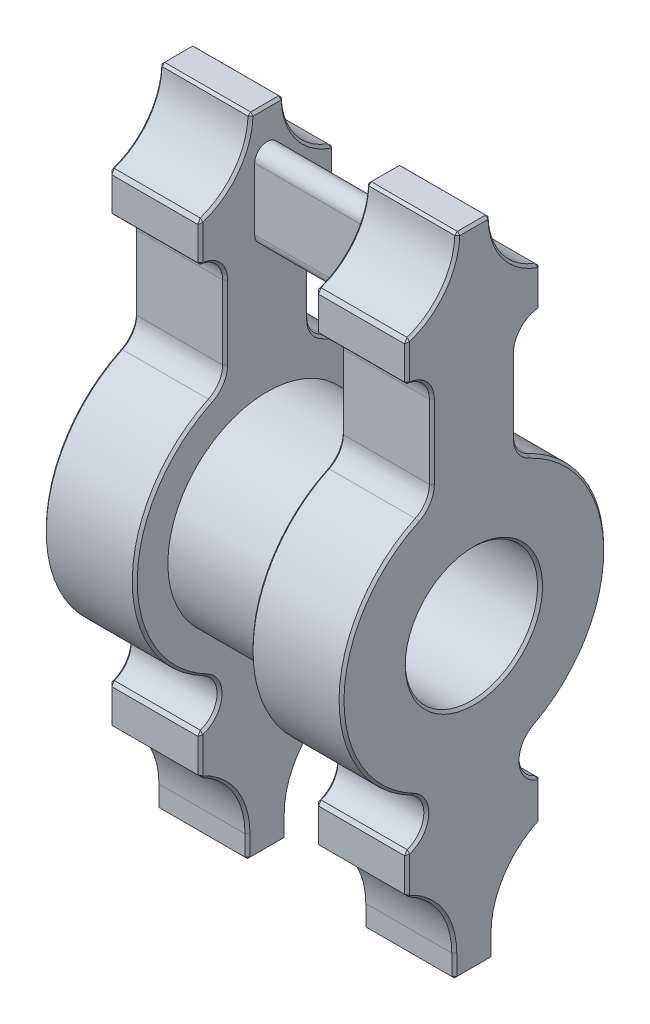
SolidWorks part; units mm, degrees
ref_plane "Спереди" through (0, 0, 0) normal (0, 0, 1) x (1, 0, 0)
ref_plane "Сверху" through (0, 0, 0) normal (0, 1, 0) x (1, 0, 0)
ref_plane "Справа" through (0, 0, 0) normal (1, 0, 0) x (0, 0, -1)
sketch "Эскиз1" plane through (0, 0, 0) normal (1, 0, 0) x (0, 0, -1)
  line L0 (0, 21) -> (0, 0) construction
  line L1 (0, 0) -> (11.8529, 0) construction
  line L2 (-2.54, 13.0559) -> (-2.54, 8.5982)
  line L3 (-1, 21) -> (1, 21)
  line L4 (-4.04, 16.9259) -> (-4.04, 14.5559)
  line L5 (2.54, 13.0559) -> (2.54, 8.5982)
  line L6 (4.04, 16.9259) -> (4.04, 14.5559)
  line L7 (0, 0) -> (0, -18) construction
  line L8 (-1.185, -18) -> (1.185, -18)
  line L9 (-4.04, -9.8948) -> (-4.04, -12.2648)
  line L10 (-4.04, -11.0798) -> (0, -11.0798) construction
  line L11 (-1.185, -18) -> (-1.185, -16.6204)
  line L12 (-2.875, -7.4655) -> (-2.875, -11.0798) construction
  line L13 (1.185, -18) -> (1.185, -16.6204)
  line L14 (4.04, -9.8948) -> (4.04, -12.2648)
  circle A0 centre (0, 0) radius 4
  arc A1 (-3.4021, 7.2406) -> (-3.6842, -7.1012) centre (0, 0) ccw
  arc A2 (-2.54, 8.5982) -> (-3.4021, 7.2406) centre (-4.04, 8.5982) cw
  arc A3 (-2.54, 13.0559) -> (-4.04, 14.5559) centre (-4.04, 13.0559) ccw
  arc A4 (-4.04, 16.9259) -> (-1, 21) centre (-5.25, 21) ccw
  arc A5 (2.54, 8.5982) -> (3.4021, 7.2406) centre (4.04, 8.5982) ccw
  arc A6 (2.54, 13.0559) -> (4.04, 14.5559) centre (4.04, 13.0559) cw
  arc A7 (4.04, 16.9259) -> (1, 21) centre (5.25, 21) cw
  arc A8 (-1.185, -16.6204) -> (-4.04, -12.2648) centre (-5.935, -16.6204) ccw
  arc A9 (-4.04, -9.8948) -> (-3.6842, -7.1012) centre (-4.375, -8.4326) ccw
  arc A10 (3.6842, -7.1012) -> (3.4021, 7.2406) centre (0, 0) ccw
  arc A11 (1.185, -16.6204) -> (4.04, -12.2648) centre (5.935, -16.6204) cw
  arc A12 (4.04, -9.8948) -> (3.6842, -7.1012) centre (4.375, -8.4326) cw
  dimension "D1" = 16
  dimension "D2" = 8
  dimension "D7" = 1.5
  dimension "D8" = 1.5
  dimension "D9" = 8.5
  dimension "D12" = 9.5
  dimension "D3" = 5.08
  dimension "D4" = 21
  dimension "D5" = 2
  dimension "D6" = 2.37
  dimension "D10" = 18
  dimension "D13" = 2.875
extrude "Бобышка-Вытянуть1" add sketch "Эскиз1" along normal blind 5.5
chamfer "Фаска1" distance 0.15 angle 45 57 edges at (2.75, -9.8948, 4.04) (2.75, -12.2648, 4.04) (2.75, -12.2648, -4.04) (2.75, -9.8948, -4.04) (2.75, 16.9259, -4.04) (2.75, 16.9259, 4.04) (5.5, 0, -4) (2.75, 14.5559, -4.04) (2.75, 14.5559, 4.04) (2.75, 21, -1) (2.75, 21, 1) (2.75, -18, 1.185) (0, 0.1573, 7.9985) (0, -8.6221, 2.887) (0, -11.0798, 4.04) (0, -14.0164, 1.9624) (0, -17.3102, 1.185) (0, -18, 0) (0, 7.7941, 2.7737) (0, 10.827, 2.54) (0, 14.1165, 2.9793) (0, 15.7409, 4.04) (0, 18.4583, 1.8438) (0, 21, 0) (0, 18.4583, -1.8438) (0, 15.7409, -4.04) (0, 14.1165, -2.9793) (0, 10.827, -2.54) (0, 7.7941, -2.7737) (0, 0.1573, -7.9985) (0, -8.6221, -2.887) (0, -11.0798, -4.04) (0, -14.0164, -1.9624) (0, -17.3102, -1.185) (2.75, -18, -1.185) (5.5, 10.827, 2.54) (5.5, 14.1165, 2.9793) (5.5, 15.7409, 4.04) (5.5, 18.4583, 1.8438) (5.5, 21, 0) (5.5, 18.4583, -1.8438) (5.5, 15.7409, -4.04) (5.5, 14.1165, -2.9793) (5.5, 10.827, -2.54) (5.5, 7.7941, -2.7737) (5.5, 0.1573, -7.9985) (5.5, -8.6221, -2.887) (5.5, -11.0798, -4.04) (5.5, -14.0164, -1.9624) (5.5, -17.3102, -1.185) (5.5, -18, 0) (5.5, -17.3102, 1.185) (5.5, -14.0164, 1.9624) (5.5, -11.0798, 4.04) (5.5, -8.6221, 2.887) (5.5, 0.1573, 7.9985) (5.5, 7.7941, 2.7737)
sketch "Эскиз2" plane through (0, 0, 0) normal (-1, 0, 0) x (0, 0, 1)
  line L0 (-0.75, 18.345) -> (-0.75, 14.595)
  line L1 (0.75, 18.345) -> (0.75, 14.595)
  line L2 (-0.8526, 21) -> (0.8526, 21) construction
  circle A0 centre (0, 0) radius 6
  circle A2 centre (0, 0) radius 4 construction
  arc A3 (0.75, 18.345) -> (-0.75, 18.345) centre (0, 18.345) ccw
  arc A4 (-0.75, 14.595) -> (0.75, 14.595) centre (0, 14.595) ccw
  circle A5 centre (0, 0) radius 4
  dimension "D1" = 12
  dimension "D2" = 1.5
  dimension "D3" = 3.75
  dimension "D4" = 2.655
extrude "Бобышка-Вытянуть2" add sketch "Эскиз2" along normal blind 3.5
ref_plane "Плоскость1" through (-3.5, 0, 0) normal (-1, 0, 0) x (0, 0, 1)
mirror "Зеркальное отражение1" about plane through (-3.5, 0, 0) normal (-1, 0, 0)
